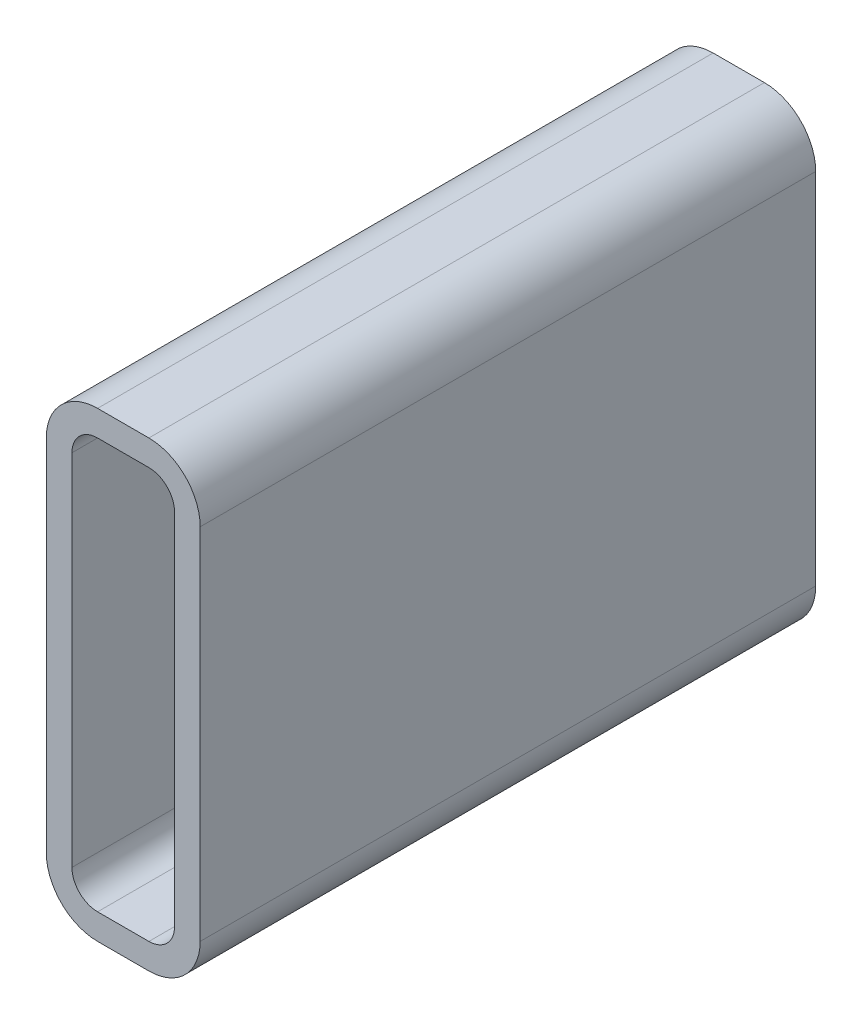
SolidWorks part; units mm, degrees
ref_plane "Front Plane" through (0, 0, 0) normal (0, 0, 1) x (1, 0, 0)
ref_plane "Top Plane" through (0, 0, 0) normal (0, 1, 0) x (1, 0, 0)
ref_plane "Right Plane" through (0, 0, 0) normal (1, 0, 0) x (0, 0, -1)
sketch "Sketch1" plane through (0, 0, 0) normal (0, 0, 1) x (1, 0, 0)
sketch_block_instance "HSS9x3x0.500-1"
sketch_block "HSS9x3x0.500"
extrude "Boss-Extrude1" add sketch "Sketch1" along normal blind 304.8
